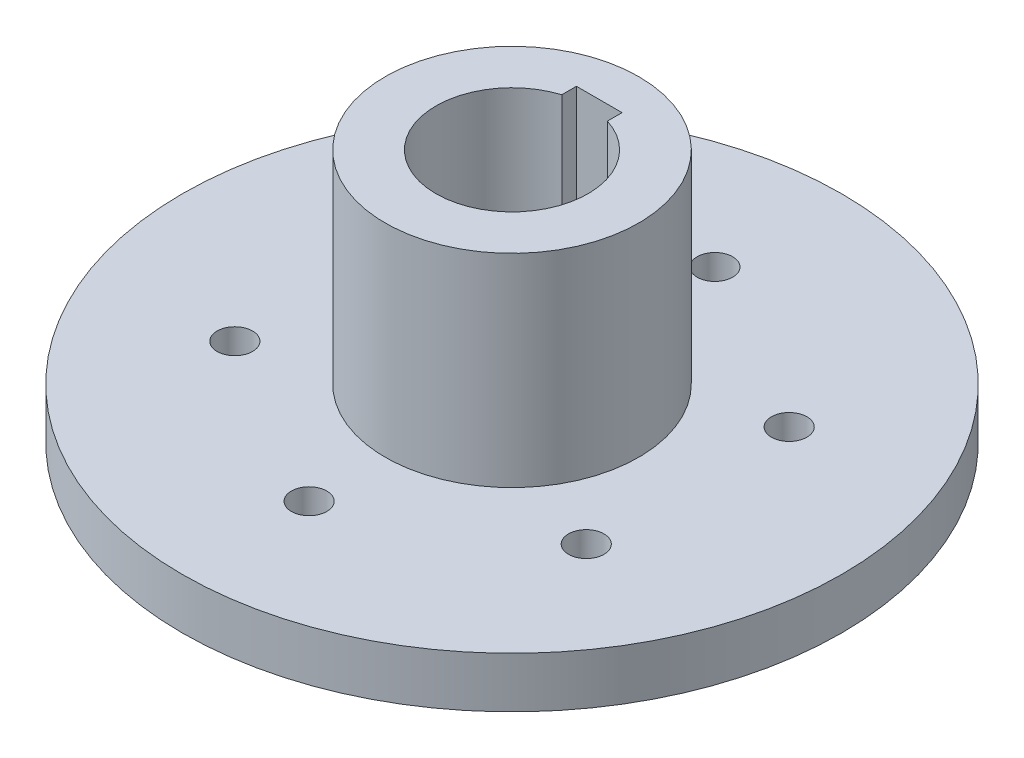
SolidWorks part; units mm, degrees
ref_plane "Front Plane" through (0, 0, 0) normal (0, 0, 1) x (1, 0, 0)
ref_plane "Top Plane" through (0, 0, 0) normal (0, 1, 0) x (1, 0, 0)
ref_plane "Right Plane" through (0, 0, 0) normal (1, 0, 0) x (0, 0, -1)
sketch "Sketch1" plane through (0, 0, 0) normal (0, 0, 1) x (1, 0, 0)
  line L0 (0, 0) -> (0, 100)
  line L1 (0, 100) -> (20, 100)
  line L2 (20, 100) -> (20, 20)
  line L3 (20, 20) -> (100, 20)
  line L4 (100, 20) -> (100, 0)
  line L5 (100, 0) -> (0, 0)
  line L6 (-30, -0.1407) -> (-30, 49999.8593) construction
  dimension "D1" = 100
  dimension "D2" = 20
  dimension "D3" = 100
  dimension "D4" = 20
  dimension "D5" = 30
revolve "Revolve1" add sketch "Sketch1" angle 360 about L6
sketch "Sketch2" plane through (0, 100, 0) normal (0, 1, 0) x (1, 0, 0)
  line L1 (-39, 34.4) -> (-21, 34.4)
  line L2 (-39, 34.4) -> (-39, 23.4)
  line L3 (-39, 23.4) -> (-21, 23.4)
  line L4 (-21, 34.4) -> (-21, 23.4)
  line L5 (-39, 34.4) -> (-21, 23.4) construction
  line L6 (-39, 23.4) -> (-21, 34.4) construction
  circle A0 centre (-30, 0) radius 30 construction
  circle A1 centre (-30, 0) radius 80 construction
  circle A2 centre (-30, 80) radius 7
  circle A9 centre (39.282, 40) radius 7
  circle A10 centre (39.282, -40) radius 7
  circle A11 centre (-30, -80) radius 7
  circle A12 centre (-99.282, -40) radius 7
  circle A13 centre (-99.282, 40) radius 7
  point P0 (-30, 28.9)
  point P8 (-30, 0)
  point P14 (0, 0)
  point P15 (0, 0)
  point P16 (0, 0)
  point P27 (-48.0346, -21.4304)
  point P28 (-30, 0)
  point P29 (0, 0)
  point P30 (0, 0)
  point P31 (0, 0)
  dimension "D4" = 160
  dimension "D5" = 14
  dimension "D1" = 18
  dimension "D2" = 11
  dimension "D3" = 34.4
  dimension "D6" = 6
extrude "Cut-Extrude1" cut sketch "Sketch2" against normal through all
